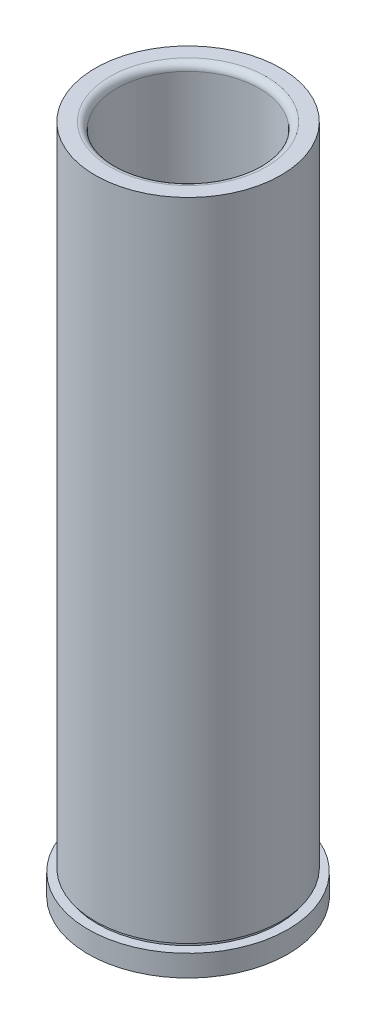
SolidWorks part; units mm, degrees
ref_plane "Front Plane" through (0, 0, 0) normal (0, 0, 1) x (1, 0, 0)
ref_plane "Top Plane" through (0, 0, 0) normal (0, 1, 0) x (1, 0, 0)
ref_plane "Right Plane" through (0, 0, 0) normal (1, 0, 0) x (0, 0, -1)
sketch "Sketch1" plane through (0, 0, 0) normal (0, 0, 1) x (1, 0, 0)
  line L0 (-813.1437, 0) -> (49186.8563, 0) construction
  line L1 (0, -1000) -> (0, 49000) construction
  line L2 (-15.8813, 149.225) -> (-15.8813, 85.725)
  line L4 (-22.225, 0) -> (-22.225, 4.7625)
  line L5 (-22.225, 4.7625) -> (-20.1358, 4.7625)
  line L6 (-20.6439, 149.225) -> (-20.6438, 5.5245)
  line L7 (-20.6439, 149.225) -> (-15.8813, 149.225)
  line L8 (-17.1513, 0.7938) -> (-17.1513, 84.455)
  line L9 (-17.1513, 0.7938) -> (-17.9451, 0)
  line L10 (-20.6438, 5.5245) -> (-20.1358, 5.5245)
  line L11 (-20.1358, 5.5245) -> (-20.1358, 4.7625)
  line L12 (-17.9451, 0) -> (-22.225, 0)
  arc A0 (-15.8813, 85.725) -> (-17.1513, 84.455) centre (-15.8813, 84.455) ccw
  dimension "D1" = 0.508
  dimension "OD" = 41.2877
  dimension "ID" = 31.7627
  dimension "FLANGETHICKNESS" = 4.7625
  dimension "FLANGEDIA" = 44.45
  dimension "D2" = 1.27
  dimension "D3" = 0.762
  dimension "D4" = 45
  dimension "D5" = 0.7937
  dimension "D6" = 149.225
  dimension "D7" = 63.5
revolve "Revolve1" add sketch "Sketch1" angle 360 about L1
fillet "Fillet1" radius 1.524 1 edges at (15.8813, 149.225, 0)
